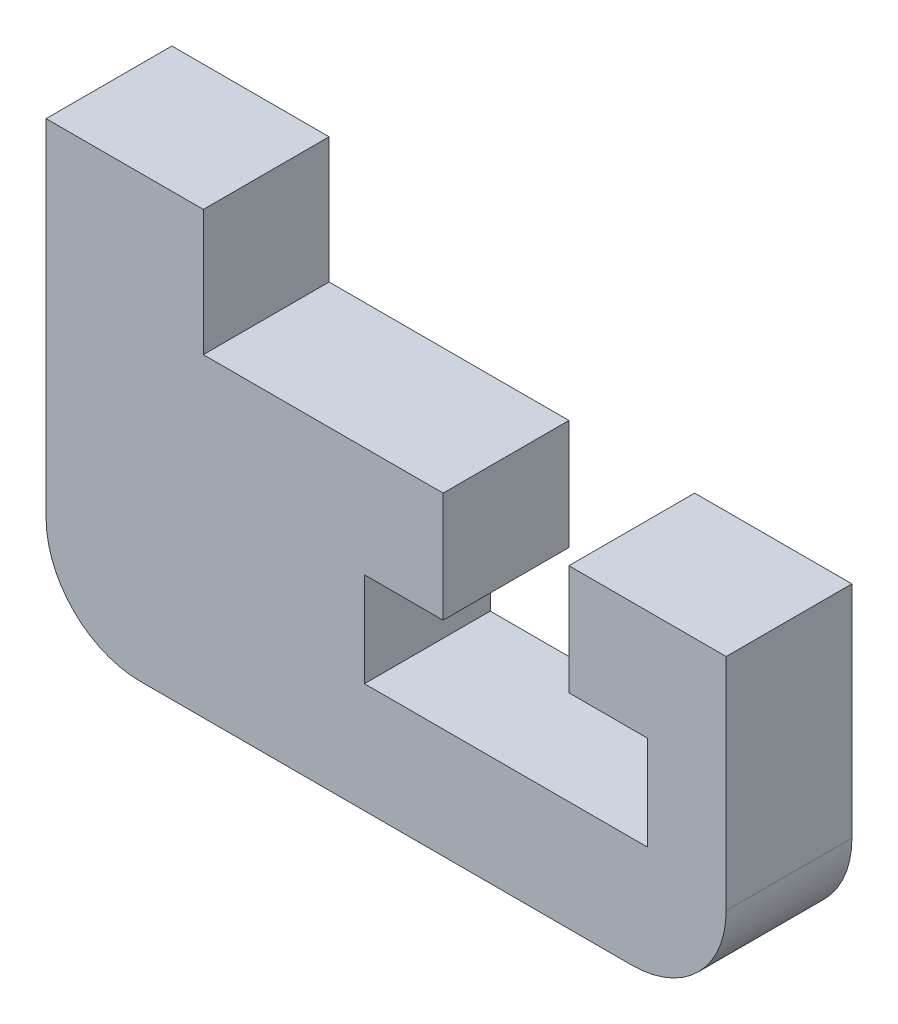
SolidWorks part; units mm, degrees
ref_plane "Alzado" through (0, 0, 0) normal (0, 0, 1) x (1, 0, 0)
ref_plane "Planta" through (0, 0, 0) normal (0, 1, 0) x (1, 0, 0)
ref_plane "Vista lateral" through (0, 0, 0) normal (1, 0, 0) x (0, 0, -1)
sketch "Croquis1" plane through (0, 0, 0) normal (0, 0, 1) x (1, 0, 0)
  line L0 (0, 23.001) -> (-5, 23.001)
  line L1 (-5, 23.001) -> (-5, 12.001)
  line L2 (11.625, 19.001) -> (16.625, 19.001)
  line L3 (16.625, 19.001) -> (16.625, 12.001)
  line L4 (11.625, 19.001) -> (11.625, 15.501)
  line L5 (11.625, 15.501) -> (14.125, 15.501)
  line L6 (14.125, 15.501) -> (14.125, 12.501)
  line L7 (14.125, 12.501) -> (5.125, 12.501)
  line L8 (5.125, 12.501) -> (5.125, 15.501)
  line L9 (5.125, 15.501) -> (7.625, 15.501)
  line L10 (7.625, 15.501) -> (7.625, 19.001)
  line L11 (7.625, 19.001) -> (0, 19.001)
  line L12 (0, 19.001) -> (0, 23.001)
  line L13 (13.625, 9.001) -> (-2, 9.001)
  arc A0 (-5, 12.001) -> (-2, 9.001) centre (-2, 12.001) ccw
  arc A1 (16.625, 12.001) -> (13.625, 9.001) centre (13.625, 12.001) cw
  dimension "D1" = 3
  dimension "D2" = 3
extrude "Saliente-Extruir1" add sketch "Croquis1" along normal blind 4
